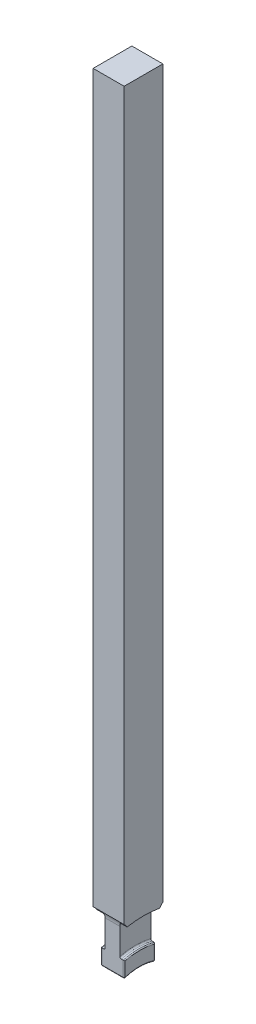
SolidWorks part; units mm, degrees
ref_plane "Front Plane" through (0, 0, 0) normal (0, 0, 1) x (1, 0, 0)
ref_plane "Top Plane" through (0, 0, 0) normal (0, 1, 0) x (1, 0, 0)
ref_plane "Right Plane" through (0, 0, 0) normal (1, 0, 0) x (0, 0, -1)
sketch "Sketch1" plane through (0, 0, 0) normal (1, 0, 0) x (0, 0, -1)
  line L0 (-5, 212) -> (-5, 0)
  line L1 (0, 249.2329) -> (0, 0) construction
  line L2 (5, 212) -> (5, 0)
  line L3 (-5, 212) -> (5, 212)
  line L6 (-5, 0) -> (5, 0)
  arc A0 (-12, 0) -> (12, 0) centre (0, 0) cw construction
  dimension "R" = 12
  dimension "L" = 200
  dimension "T" = 10
extrude "Boss-Extrude1" add sketch "Sketch1" along normal mid plane 8
sketch "Sketch8" plane through (0, 0, 0) normal (1, 0, 0) x (0, 0, -1)
  circle A0 centre (0, 0) radius 12
  arc A1 (12, 0) -> (-12, 0) centre (0, 0) ccw construction
extrude "Cut-Extrude4" cut sketch "Sketch8" against normal through all both and the other way through all
sketch "Sketch2" plane through (0, 0, 0) normal (0, 0, 1) x (1, 0, 0)
  line L0 (4, 16) -> (1.905, 16)
  line L1 (4, 212) -> (4, 10.9087) construction
  line L2 (1.905, 16) -> (1.905, 24)
  line L3 (1.905, 24) -> (4, 24)
  line L4 (4, 24) -> (4, 16)
  line L5 (0, 29.9173) -> (0, 0) construction
  line L6 (-4, 24) -> (-4, 16)
  line L7 (-1.905, 24) -> (-4, 24)
  line L8 (-1.905, 16) -> (-1.905, 24)
  line L9 (-4, 16) -> (-1.905, 16)
  line L10 (-8.8482, 0) -> (24.5305, 0) construction
  dimension "D1" = 3.81
  dimension "D2" = 24
  dimension "D3" = 16
revolve "Cut-Revolve1" cut sketch "Sketch2" angle 360 about L10
sketch "Sketch6" plane through (0, 0, 0) normal (1, 0, 0) x (0, 0, -1)
  line L0 (0, 19.903) -> (0, 0) construction
  line L1 (4, 0) -> (23.05, 0)
  line L2 (4, 0) -> (4, 22.6124)
  line L3 (6.3876, 25) -> (23.05, 25)
  line L4 (23.05, 0) -> (23.05, 25)
  line L9 (-4, 0) -> (-23.05, 0)
  line L10 (-23.05, 0) -> (-23.05, 25)
  line L11 (-6.3876, 25) -> (-23.05, 25)
  line L12 (-4, 0) -> (-4, 22.6124)
  arc A0 (4, 22.6124) -> (6.3876, 25) centre (6.3876, 22.6124) cw
  arc A1 (-4, 22.6124) -> (-6.3876, 25) centre (-6.3876, 22.6124) ccw
  dimension "D3" = 2.3876
  dimension "D1" = 25
  dimension "MT" = 8
  dimension "D2" = 19.05
extrude "Cut-Extrude2" cut sketch "Sketch6" against normal through all both and the other way through all
sketch "Sketch7" plane through (0, 0, 0) normal (0, 0, 1) x (1, 0, 0)
  line L6 (-4, 16) -> (-3, 16)
  line L8 (-4, 16) -> (-4, 0)
  line L9 (-4, 0) -> (-3, 0)
  line L10 (-3, 16) -> (-3, 0)
  line L11 (0, 16.5651) -> (0, 5.9342) construction
  line L12 (3, 16) -> (3, 0)
  line L13 (4, 0) -> (3, 0)
  line L14 (4, 16) -> (4, 0)
  line L15 (4, 16) -> (3, 16)
  dimension "MW" = 6
extrude "Cut-Extrude3" cut sketch "Sketch7" against normal through all both and the other way through all
fillet "Fillet1" radius 0.762 2 edges at (-1.905, 24, 0) (1.905, 24, 0)
fillet "Fillet2" radius 0.381 2 edges at (-1.905, 16, 0) (1.905, 16, 0)
fillet "Fillet3" radius 0.254 10 edges at (3, 13.4028, -4) (3, 13.4028, 4) (3, 16, 0) (-3, 13.4028, 4) (-3, 13.4028, -4) (-3, 16, 0) (3, 12, 0) (-3, 12, 0) (0, 11.3137, -4) (0, 11.3137, 4)
